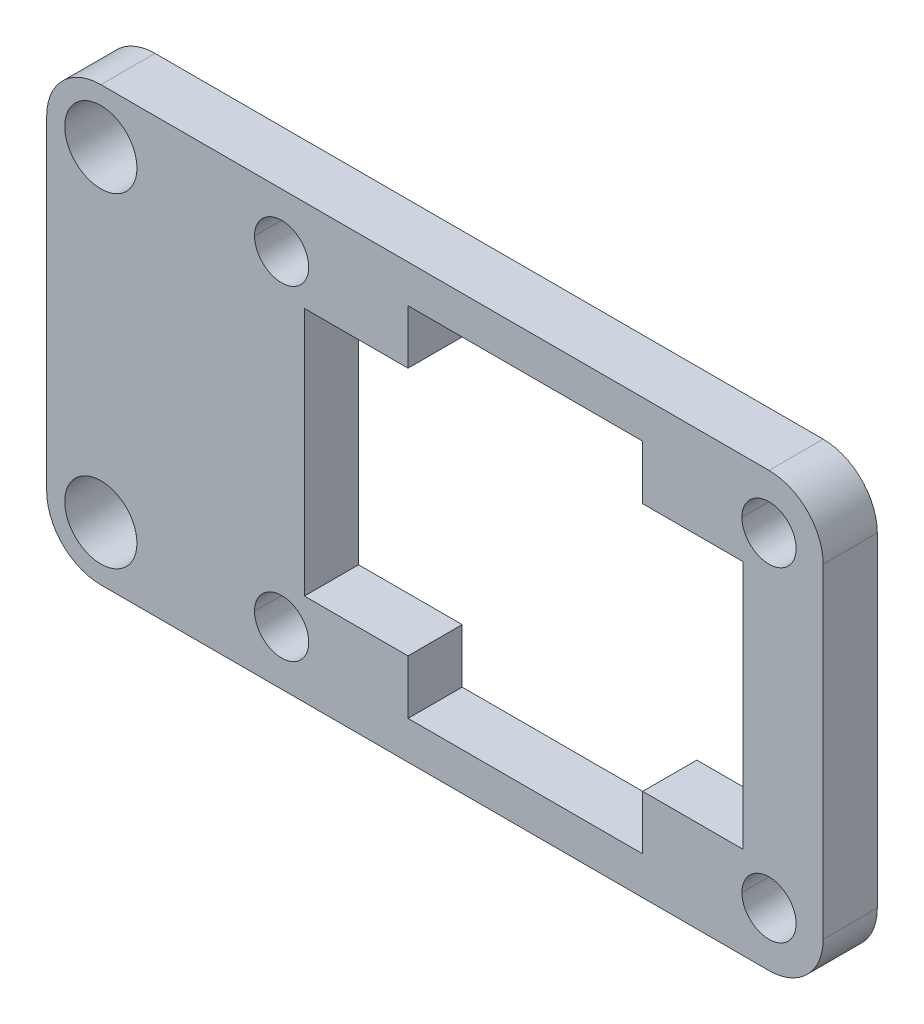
SolidWorks part; units mm, degrees
ref_plane "Front Plane" through (0, 0, 0) normal (0, 0, 1) x (1, 0, 0)
ref_plane "Top Plane" through (0, 0, 0) normal (0, 1, 0) x (1, 0, 0)
ref_plane "Right Plane" through (0, 0, 0) normal (1, 0, 0) x (0, 0, -1)
imported_body "Imported1"
sketch "Sketch1" plane through (0, 0, 0) normal (0, 0, 1) x (1, 0, 0)
  line L0 (38.01, -40.41) -> (43.75, -40.41)
  line L1 (56.75, -40.41) -> (62.31, -40.41)
  line L2 (38.01, -40.41) -> (38.01, -54.21)
  line L3 (62.31, -54.21) -> (56.75, -54.21)
  line L4 (62.31, -40.41) -> (62.31, -54.21)
  line L5 (43.75, -54.21) -> (38.01, -54.21)
  line L6 (43.75, -40.41) -> (43.75, -37.41)
  line L7 (43.75, -37.41) -> (56.75, -37.41)
  line L8 (56.75, -40.41) -> (56.75, -37.41)
  line L10 (56.75, -54.21) -> (56.75, -57.21)
  line L11 (56.75, -57.21) -> (43.75, -57.21)
  line L12 (43.75, -54.21) -> (43.75, -57.21)
extrude "Cut-Extrude1" cut sketch "Sketch1" along normal blind 3
sketch "Sketch2" plane through (0, 0, 3) normal (0, 0, 1) x (1, 0, 0)
  circle A0 centre (26.7322, -38.3125) radius 2
  circle A1 centre (26.7322, -56.3125) radius 2
extrude "Cut-Extrude2" cut sketch "Sketch2" against normal blind 3
